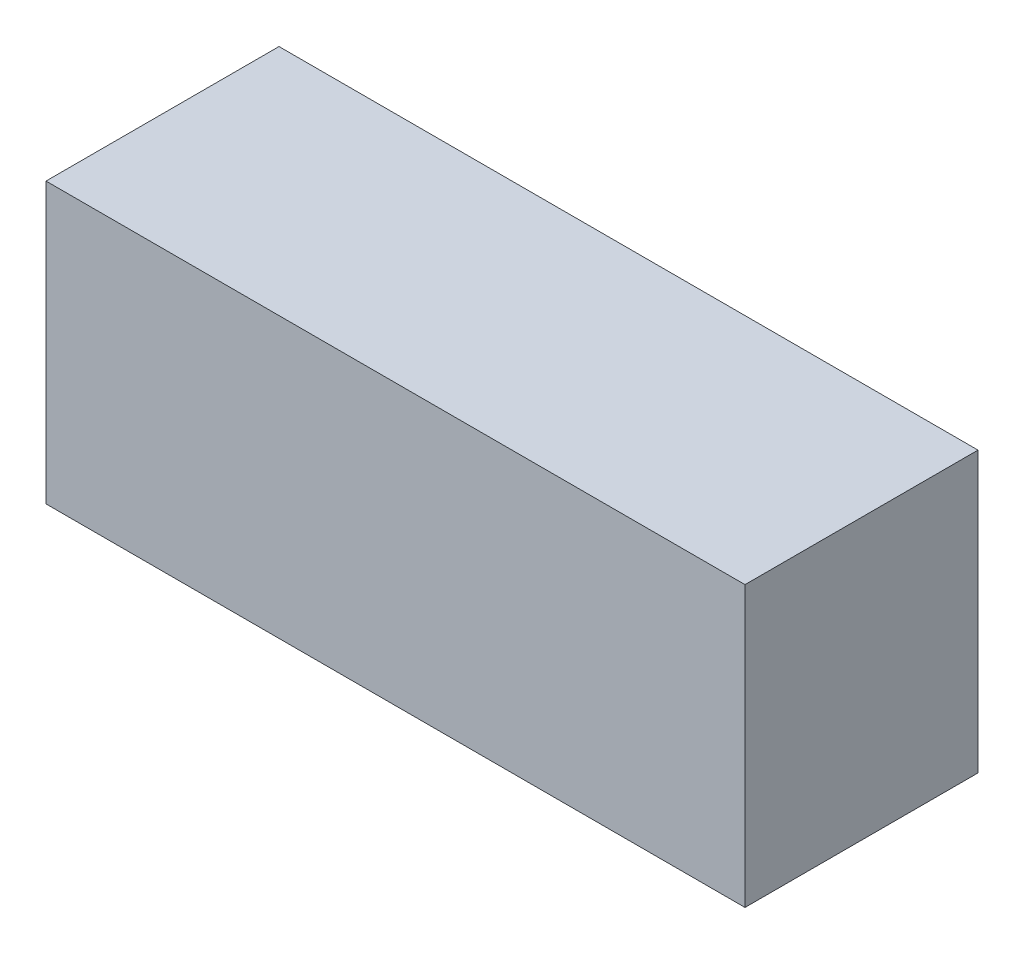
SolidWorks part; units mm, degrees
ref_plane "Face" through (0, 0, 0) normal (0, 0, 1) x (1, 0, 0)
ref_plane "Dessus" through (0, 0, 0) normal (0, 1, 0) x (1, 0, 0)
ref_plane "Droite" through (0, 0, 0) normal (1, 0, 0) x (0, 0, -1)
sketch "Esquisse1" plane through (0, 0, 0) normal (0, 0, 1) x (1, 0, 0)
  line L1 (0, 0) -> (30, 0)
  line L2 (0, 0) -> (0, -12)
  line L3 (0, -12) -> (30, -12)
  line L4 (30, 0) -> (30, -12)
  dimension "D1" = 30
  dimension "D2" = 12
extrude "Base-Extrusion" add sketch "Esquisse1" along normal blind 10
